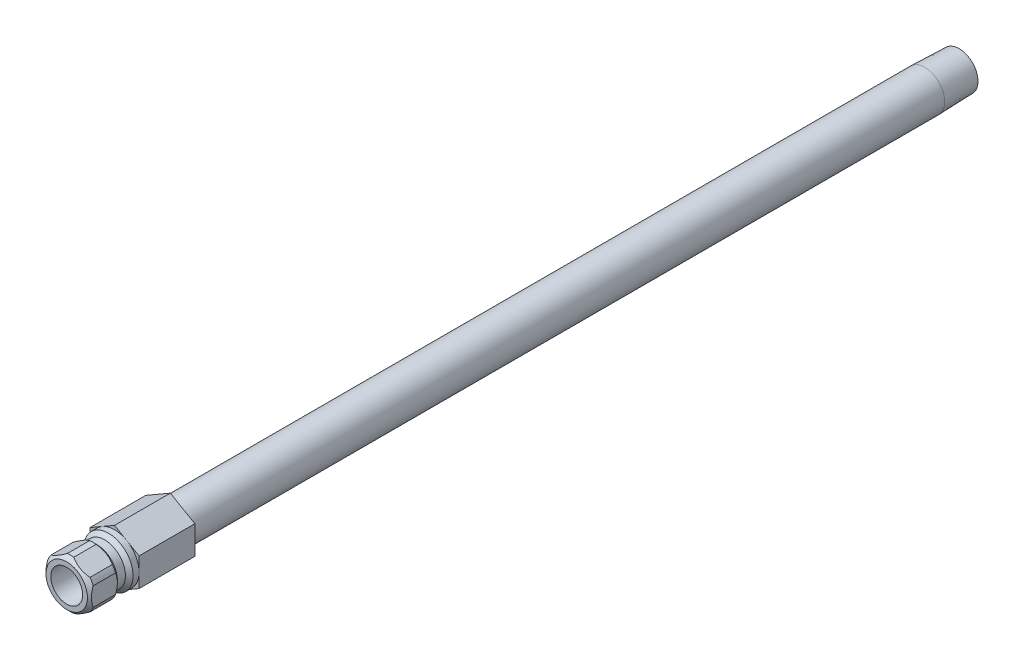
SolidWorks part; units mm, degrees
ref_plane "Front Plane" through (0, 0, 0) normal (0, 0, 1) x (1, 0, 0)
ref_plane "Top Plane" through (0, 0, 0) normal (0, 1, 0) x (1, 0, 0)
ref_plane "Right Plane" through (0, 0, 0) normal (1, 0, 0) x (0, 0, -1)
sketch "Sketch1" plane through (0, 0, 0) normal (1, 0, 0) x (0, 0, -1)
  line L0 (0, 0) -> (-12.7, 0) construction
  line L1 (-9.525, 3.175) -> (-9.525, 4.1275)
  line L2 (-3.556, 4.1275) -> (-3.556, 0) construction
  line L3 (-8.763, 4.8895) -> (-4.318, 4.8895)
  line L4 (0, 3.9688) -> (0, 3.175) construction
  line L5 (-3.556, 4.1275) -> (-1.9558, 4.1275)
  line L6 (-1.1938, 4.8895) -> (0, 4.8895)
  line L7 (0, 4.8895) -> (0, 3.9688)
  line L8 (-3.556, 4.1275) -> (-4.318, 4.8895)
  line L9 (-1.9558, 4.1275) -> (-1.1938, 4.8895)
  line L10 (-9.525, 4.1275) -> (-8.763, 4.8895)
  line L12 (0, 3.9688) -> (161.417, 3.9688)
  line L13 (161.417, 3.9688) -> (168.275, 3.7544)
  line L14 (168.275, 3.7544) -> (168.275, 2.3813)
  line L15 (0, 0) -> (11.1125, 0) construction
  line L16 (11.1125, 0) -> (11.1125, 4.8895) construction
  line L17 (11.1125, 4.8895) -> (0, 4.8895) construction
  line L18 (0.127, 3.175) -> (0.127, 2.3813)
  line L19 (0.127, 3.175) -> (-9.525, 3.175)
  line L20 (0.127, 2.3813) -> (168.275, 2.3813)
  line L21 (0, 2.6543) -> (0, 0) construction
  dimension "D1" = 9.525
  dimension "D2" = 1.6002
  dimension "D3" = 0.762
  dimension "D4" = 45
  dimension "D5" = 5.969
  dimension "D6" = 45
  dimension "D7" = 1.79
  dimension "D8" = 6.858
  dimension "D9" = 177.8
  dimension "D10" = 3.175
  dimension "D11" = 20.6375
  dimension "D12" = 6.35
  dimension "D13" = 4.7625
  dimension "D14" = 9.779
  dimension "D15" = 7.9375
  dimension "D16" = 9.652
revolve "Revolve1" add sketch "Sketch1" angle 360 about L0
sketch "Sketch2" plane through (0, 0, 0) normal (0, 0, 1) x (1, 0, 0)
  line L1 (-4.8895, 2.823) -> (-4.8895, -2.823)
  line L2 (-4.8895, -2.823) -> (0, -5.6459)
  line L3 (0, -5.6459) -> (4.8895, -2.823)
  line L4 (4.8895, -2.823) -> (4.8895, 2.823)
  line L5 (4.8895, 2.823) -> (0, 5.6459)
  line L6 (0, 5.6459) -> (-4.8895, 2.823)
  circle A0 centre (0, 0) radius 4.8895 construction
  circle A1 centre (0, 0) radius 2.3813 construction
  circle A2 centre (0, 0) radius 2.3813
  dimension "D1" = 9.779
extrude "Boss-Extrude1" add sketch "Sketch2" against normal up to vertex (11.1125 mm away) from vertex at 0
sketch "Sketch3" plane through (0, 0, 0) normal (0, 0, 1) x (1, 0, 0)
  line L1 (-4.5212, -2.6103) -> (0, -5.2206)
  line L2 (0, -5.2206) -> (4.5212, -2.6103)
  line L3 (4.5212, -2.6103) -> (4.5212, 2.6103)
  line L4 (4.5212, 2.6103) -> (0, 5.2206)
  line L5 (0, 5.2206) -> (-4.5212, 2.6103)
  line L6 (-4.5212, 2.6103) -> (-4.5212, -2.6103)
  circle A0 centre (0, 0) radius 4.5212 construction
  dimension "D1" = 9.0424
extrude "Cut-Extrude1" cut sketch "Sketch3" along normal through all from vertex at 3.556 flip side to cut
